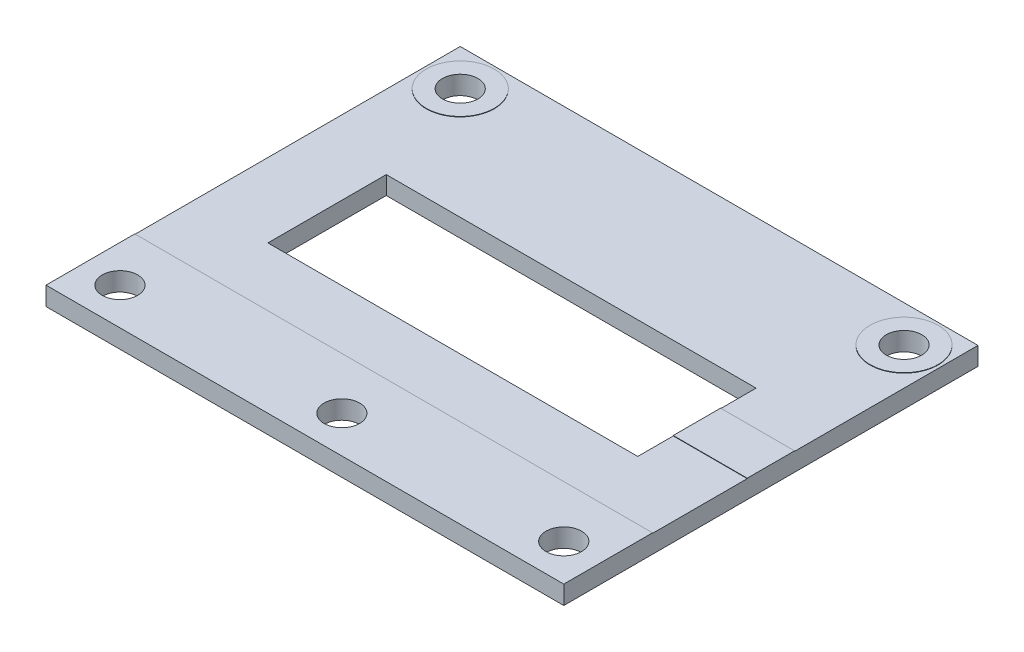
SolidWorks part; units mm, degrees
ref_plane "Front Plane" through (0, 0, 0) normal (0, 0, 1) x (1, 0, 0)
ref_plane "Top Plane" through (0, 0, 0) normal (0, 1, 0) x (1, 0, 0)
ref_plane "Right Plane" through (0, 0, 0) normal (1, 0, 0) x (0, 0, -1)
sketch "Sketch1" plane through (0, 0, 0) normal (0, 1, 0) x (1, 0, 0)
  line L1 (-22.225, -17.78) -> (22.225, -17.78)
  line L2 (-22.225, -17.78) -> (-22.225, 17.78)
  line L3 (-22.225, 17.78) -> (22.225, 17.78)
  line L4 (22.225, -17.78) -> (22.225, 17.78)
  line L5 (-22.225, -17.78) -> (22.225, 17.78) construction
  line L6 (-22.225, 17.78) -> (22.225, -17.78) construction
  point P0 (0, 0)
extrude "Boss-Extrude1" add sketch "Sketch1" along normal blind 1.524
sketch "Sketch2" plane through (0, 1.524, 0) normal (0, 1, 0) x (1, 0, 0)
  line L2 (-22.225, -10.16) -> (22.225, -10.16)
  line L3 (-22.225, 17.78) -> (-22.225, -17.78) construction
  line L4 (22.225, -17.78) -> (22.225, 17.78) construction
  line L5 (22.225, -10.16) -> (22.225, -17.78)
  line L7 (22.225, -17.78) -> (-22.225, -17.78)
  line L8 (-22.225, -17.78) -> (-22.225, -10.16)
  circle A0 centre (-19.05, 14.605) radius 2.921
  circle A1 centre (19.05, 14.605) radius 2.921
extrude "Boss-Extrude2" add sketch "Sketch2" along normal blind 0.0356
sketch "Sketch3" plane through (0, 0, 0) normal (0, -1, 0) x (1, 0, 0)
  line L1 (-22.225, -17.78) -> (22.225, -17.78)
  line L2 (-22.225, -17.78) -> (-22.225, 17.78)
  line L3 (-22.225, 17.78) -> (22.225, 17.78)
  line L4 (22.225, -17.78) -> (22.225, 17.78)
  line L5 (-22.225, -17.78) -> (22.225, 17.78) construction
  line L6 (-22.225, 17.78) -> (22.225, -17.78) construction
  point P0 (0, 0)
extrude "Boss-Extrude3" add sketch "Sketch3" along normal blind 0.0356
sketch "Sketch4" plane through (0, 1.524, 0) normal (0, 1, 0) x (1, 0, 0)
  line L5 (-15.875, -5.08) -> (15.875, -5.08)
  line L6 (-15.875, -5.08) -> (-15.875, 5.08)
  line L7 (-15.875, 5.08) -> (15.875, 5.08)
  line L8 (15.875, -5.08) -> (15.875, 5.08)
  line L9 (-15.875, -5.08) -> (15.875, 5.08) construction
  line L10 (-15.875, 5.08) -> (15.875, -5.08) construction
  point P9 (0, 0)
extrude "Cut-Extrude1" cut sketch "Sketch4" against normal through all
sketch "Sketch5" plane through (0, 1.5596, 0) normal (0, 1, 0) x (1, 0, 0)
  circle A0 centre (-19.05, 14.605) radius 1.524
  circle A1 centre (19.05, 14.605) radius 1.524
  circle A4 centre (-19.05, -14.605) radius 1.524
  circle A5 centre (19.05, -14.605) radius 1.524
  circle A6 centre (0, -14.605) radius 1.524
sketch "Sketch6" plane through (0, 1.524, 0) normal (0, 1, 0) x (1, 0, 0)
  line L2 (22.225, -10.16) -> (22.225, 14.605) construction
  line L4 (15.875, -2.032) -> (22.225, -2.032)
  line L5 (15.875, -2.032) -> (15.875, 2.032)
  line L6 (15.875, 2.032) -> (22.225, 2.032)
  line L7 (22.225, -2.032) -> (22.225, 2.032)
  line L8 (15.875, -2.032) -> (22.225, 2.032) construction
  line L9 (15.875, 2.032) -> (22.225, -2.032) construction
  point P6 (19.05, 0)
extrude "Cut-Extrude4" cut sketch "Sketch5" against normal through all
extrude "Boss-Extrude4" add sketch "Sketch6" along normal blind 0.0356
